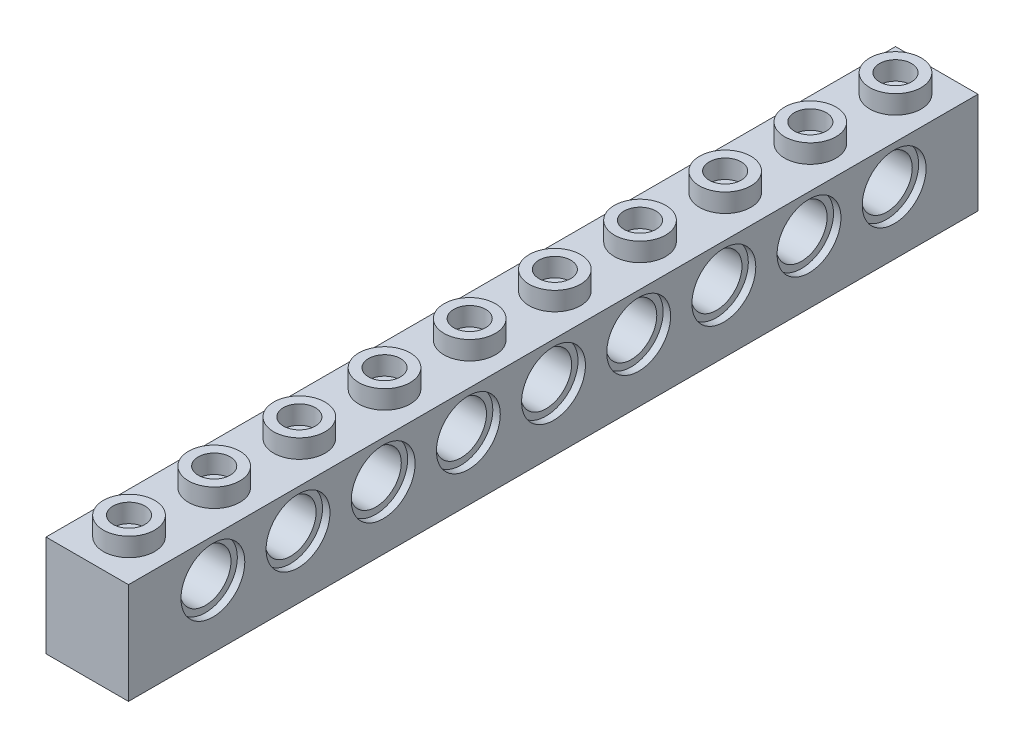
SolidWorks part; units mm, degrees
ref_plane "Front Plane" through (0, 0, 0) normal (0, 0, 1) x (1, 0, 0)
ref_plane "Top Plane" through (0, 0, 0) normal (0, 1, 0) x (1, 0, 0)
ref_plane "Right Plane" through (0, 0, 0) normal (1, 0, 0) x (0, 0, -1)
sketch "Sketch1" plane through (0, 0, 0) normal (0, 0, 1) x (1, 0, 0)
  line L1 (3.875, -4.75) -> (-3.875, -4.75)
  line L2 (3.875, -4.75) -> (3.875, 4.75)
  line L3 (3.875, 4.75) -> (-3.875, 4.75)
  line L4 (-3.875, -4.75) -> (-3.875, 4.75)
  line L5 (3.875, -4.75) -> (-3.875, 4.75) construction
  line L6 (3.875, 4.75) -> (-3.875, -4.75) construction
  point P0 (0, 0)
  dimension "D1" = 7.75
  dimension "D2" = 9.5
extrude "Boss-Extrude1" add sketch "Sketch1" along normal blind 79.8
sketch "Sketch2" plane through (0, 4.75, 0) normal (0, 1, 0) x (1, 0, 0)
  line L0 (0, 0) -> (0, -79.8) construction
  line L1 (3.875, -79.8) -> (-3.875, -79.8) construction
  line L2 (3.875, 0) -> (-3.875, 0) construction
  circle A0 centre (0, -3.875) radius 2.415
  circle A1 centre (0, -3.875) radius 1.5
  dimension "D1" = 3
  dimension "D3" = 4.83
  dimension "D2" = 3.875
extrude "Boss-Extrude3" add sketch "Sketch2" along normal blind 1.75
sketch "Sketch3" plane through (0, 4.75, 0) normal (0, 1, 0) x (-1, 0, 0)
  line L0 (0, 0) -> (0, 79.8) construction
  line L1 (-3.875, 79.8) -> (3.875, 79.8) construction
pattern_linear "LPattern1" count 10 spacing 8 along (0, 0, 1) of "Boss-Extrude3"
sketch "Sketch4" plane through (0, -4.75, 0) normal (0, -1, 0) x (1, 0, 0)
  line L12 (-2.425, 1.45) -> (2.425, 1.45)
  line L13 (2.425, 1.45) -> (2.425, 78.35)
  line L14 (2.425, 78.35) -> (-2.425, 78.35)
  line L15 (-2.425, 78.35) -> (-2.425, 1.45)
  line L16 (-2.425, 1.45) -> (2.425, 1.45)
  line L17 (2.425, 1.45) -> (2.425, 78.35)
  line L18 (2.425, 78.35) -> (-2.425, 78.35)
  line L19 (-2.425, 78.35) -> (-2.425, 1.45)
  dimension "D1" = 1.45
extrude "Cut-Extrude1" cut sketch "Sketch4" against normal blind 1.75
sketch "Sketch5" plane through (0, -3, 0) normal (0, -1, 0) x (1, 0, 0)
  line L0 (0, 78.35) -> (0, 1.45) construction
  line L1 (2.425, 78.35) -> (-2.425, 78.35) construction
  line L2 (-2.425, 1.45) -> (2.425, 1.45) construction
  line L3 (-3.875, 79.8) -> (3.875, 79.8) construction
  circle A0 centre (0, 72.2) radius 1.5
  dimension "D1" = 3
  dimension "D2" = 7.6
extrude "Boss-Extrude4" add sketch "Sketch5" along normal blind 1.75
pattern_linear "LPattern2" count 9 spacing 8 along (0, 0, -1) of "Boss-Extrude4"
sketch "Sketch6" plane through (-3.875, 0, 0) normal (-1, 0, 0) x (0, 0, 1)
  line L0 (0, 1.15) -> (79.8, 1.15) construction
  line L1 (0, 4.75) -> (0, -4.75) construction
  line L2 (79.8, 4.75) -> (79.8, -4.75) construction
  line L3 (79.8, 4.75) -> (0, 4.75) construction
  line L4 (71.875, 7.5557) -> (71.875, -5.472) construction
  line L5 (73.46, 6.5) -> (73.46, 4.75) construction
  circle A0 centre (71.875, 1.15) radius 3
  dimension "D3" = 6
  dimension "D1" = 3.6
  dimension "D2" = 1.585
extrude "Cut-Extrude2" cut sketch "Sketch6" against normal blind 0.7
sketch "Sketch7" plane through (3.875, 0, 0) normal (1, 0, 0) x (0, 0, -1)
  circle A0 centre (-71.875, 1.15) radius 3
  dimension "D1" = 6
extrude "Cut-Extrude3" cut sketch "Sketch7" against normal blind 0.7
sketch "Sketch8" plane through (3.875, 0, 0) normal (1, 0, 0) x (0, 0, -1)
  circle A0 centre (-71.875, 1.15) radius 2.4
  dimension "D1" = 4.8
extrude "Cut-Extrude4" cut sketch "Sketch8" against normal through all
pattern_linear "LPattern3" count 9 spacing 8 along (0, 0, -1) of "Cut-Extrude4", "Cut-Extrude3", "Cut-Extrude2"
